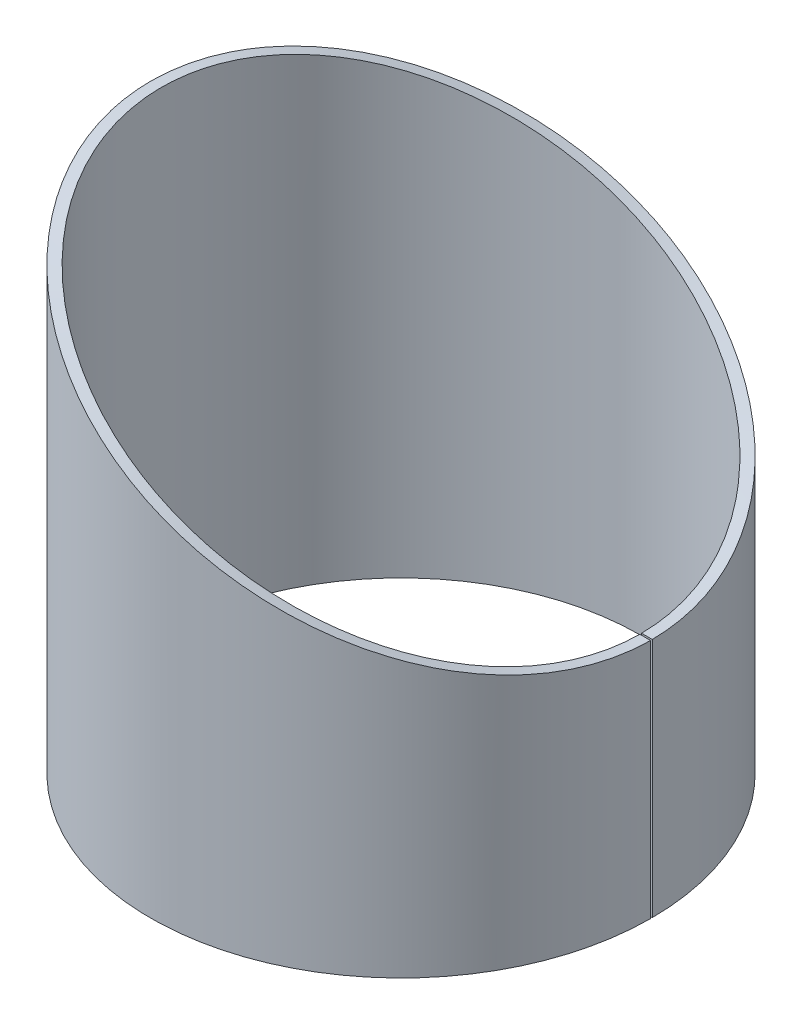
SolidWorks part; units mm, degrees
ref_plane "前视基准面" through (0, 0, 0) normal (0, 0, 1) x (1, 0, 0)
ref_plane "上视基准面" through (0, 0, 0) normal (0, 1, 0) x (1, 0, 0)
ref_plane "右视基准面" through (0, 0, 0) normal (1, 0, 0) x (0, 0, -1)
imported_body "基体零件-等径裤形管-1"
sheet metal parameters "钣金1" parameters "D1"=0.7366, "厚度"=6
bend "圆角折弯1" bend radius 134 bend angle 359.591 parameters "D5"=1
flatten bends "展开-折弯1"
sketch "尖角-草图1" plane through (-160.0009, -384.3712, -0.5) normal (1, 0, -0.0036) x (-0.0036, 0, -1)
  line L0 (420.4948, 67.3587) -> (420.4948, -67.3587) construction
  dimension "D1" = 0
process bends "加工-折弯1" parameters "D1"=0
sketch "平面-草图1" plane through (-160.0009, -384.3712, -0.5) normal (1, 0, -0.0036) x (-0.0036, 0, -1)
